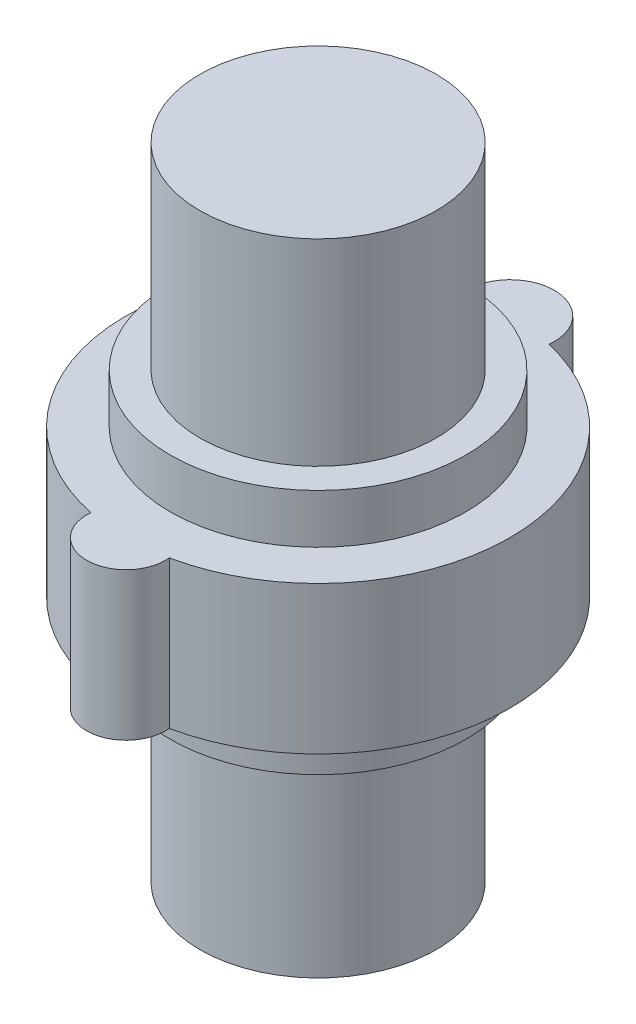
SolidWorks part; units mm, degrees
ref_plane "Plano frontal" through (0, 0, 0) normal (0, 0, 1) x (1, 0, 0)
ref_plane "Plano superior" through (0, 0, 0) normal (0, 1, 0) x (1, 0, 0)
ref_plane "Plano direito" through (0, 0, 0) normal (1, 0, 0) x (0, 0, -1)
sketch "Esboço1" plane through (0, 0, 0) normal (0, 1, 0) x (1, 0, 0)
  line L0 (0, 0) -> (0, 3.9) construction
  line L1 (0, 0) -> (0, -3.9) construction
  arc A0 (-0.894, 3.7962) -> (-0.7958, -3.8179) centre (0, 0) ccw
  arc A1 (-0.894, 3.7962) -> (0.894, 3.7962) centre (0, 3.9) cw
  arc A2 (-0.7958, -3.8179) -> (0.7958, -3.8179) centre (0, -3.9) ccw
  arc A3 (0.7958, -3.8179) -> (0.894, 3.7962) centre (0, 0) ccw
  arc A4 (-0.7958, -3.8179) -> (0.7958, -3.8179) centre (0, 0) ccw construction
  point P5 (0, 4.3107)
  point P9 (0, -3.6736)
  point P10 (0, 0)
  point P11 (0, -3.9)
  point P12 (0.4401, -3.8751)
  dimension "D1" = 7.8
  dimension "D2" = 0.8
  dimension "D3" = 0.9
extrude "Ressalto-extrusão1" add sketch "Esboço1" along normal blind 3
sketch "Esboço2" plane through (0, 3, 0) normal (0, 1, 0) x (1, 0, 0)
  circle A0 centre (0, 0) radius 3
  dimension "D1" = 6
extrude "Ressalto-extrusão2" add sketch "Esboço2" along normal blind 1 contours A0
sketch "Esboço3" plane through (0, 4, 0) normal (0, 1, 0) x (1, 0, 0)
  circle A0 centre (0, 0) radius 2.4
  dimension "D1" = 4.8
extrude "Ressalto-extrusão3" add sketch "Esboço3" along normal blind 4
sketch "Esboço4" plane through (0, 0, 0) normal (0, -1, 0) x (-1, 0, 0)
  circle A0 centre (0, 0) radius 3
  dimension "D1" = 6
extrude "Ressalto-extrusão4" add sketch "Esboço4" along normal blind 1
sketch "Esboço5" plane through (0, -1, 0) normal (0, -1, 0) x (1, 0, 0)
  circle A0 centre (0, 0) radius 2.4
  dimension "D1" = 4.8
extrude "Ressalto-extrusão5" add sketch "Esboço5" along normal blind 4
ref_plane "Plano1" through (0, 0, -3.7962) normal (0, 0, 1) x (1, 0, 0)
